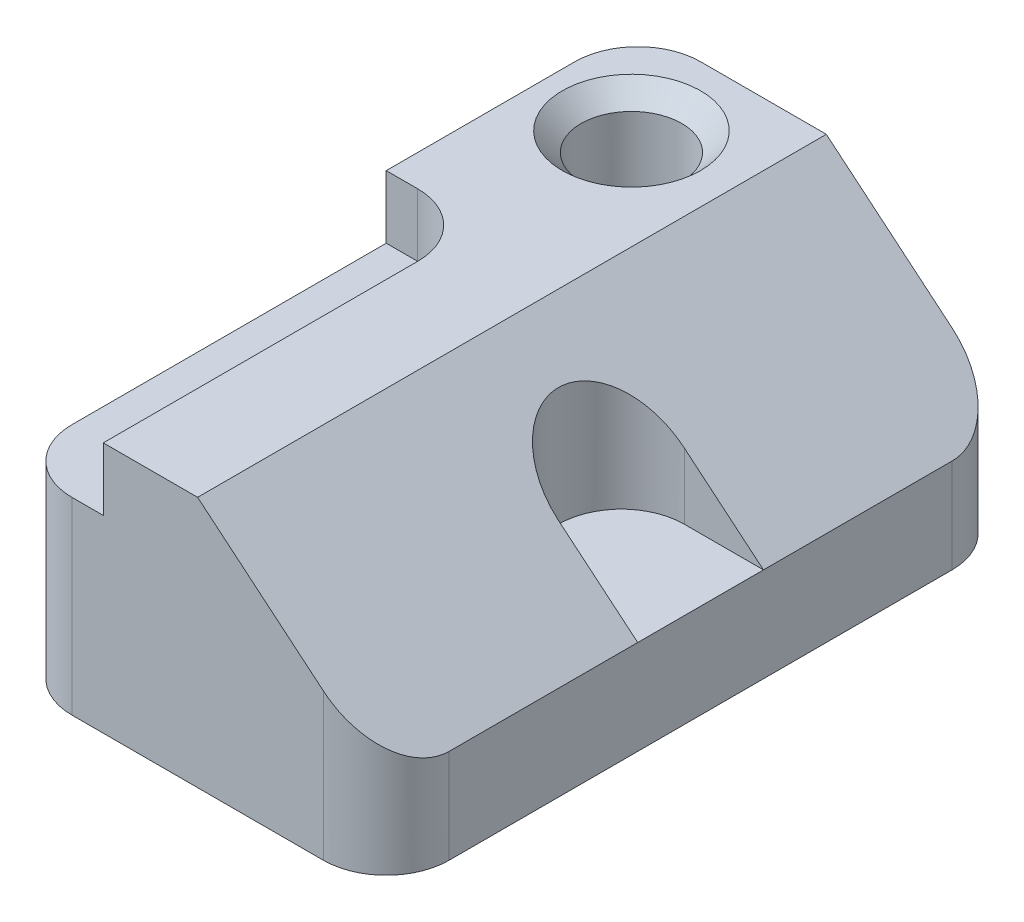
SolidWorks part; units mm, degrees
ref_plane "Front Plane" through (0, 0, 0) normal (0, 0, 1) x (1, 0, 0)
ref_plane "Top Plane" through (0, 0, 0) normal (0, 1, 0) x (1, 0, 0)
ref_plane "Right Plane" through (0, 0, 0) normal (1, 0, 0) x (0, 0, -1)
sketch "Sketch1" plane through (0, 0, 0) normal (0, 0, 1) x (1, 0, 0)
  line L0 (0, 0) -> (76.2, 0)
  line L1 (76.2, 0) -> (76.2, 19.05)
  line L2 (76.2, 19.05) -> (38.1, 50.8)
  line L3 (38.1, 50.8) -> (0, 50.8)
  line L4 (0, 50.8) -> (0, 0)
  dimension "D1" = 50.8
  dimension "D2" = 76.2
  dimension "D3" = 19.05
  dimension "D4" = 38.1
extrude "Extrude1" add sketch "Sketch1" along normal blind 127
sketch "Sketch2" plane through (0, 50.8, 0) normal (0, 1, 0) x (-1, 0, 0)
  line L0 (0, 127) -> (0, 0) construction
  line L1 (-38.1, 0) -> (0, 0) construction
  circle A0 centre (-17.78, 19.05) radius 10.16
  dimension "D1" = 20.32
  dimension "D2" = 17.78
  dimension "D3" = 19.05
extrude "Cut-Extrude1" cut sketch "Sketch2" against normal through all
chamfer "Chamfer1" distance 3.81 angle 45 1 edges at (7.62, 50.8, 19.05)
sketch "Sketch3" plane through (0, 50.8, 0) normal (0, 1, 0) x (-1, 0, 0)
  line L1 (0, 127) -> (-19.05, 127)
  line L2 (0, 127) -> (0, 50.8)
  line L3 (0, 50.8) -> (-6.35, 50.8)
  line L4 (-19.05, 127) -> (-19.05, 63.5)
  arc A0 (-6.35, 50.8) -> (-19.05, 63.5) centre (-6.35, 63.5) cw
  point P6 (-19.05, 50.8)
  dimension "D3" = 12.7
  dimension "D1" = 76.2
  dimension "D2" = 19.05
extrude "Cut-Extrude2" cut sketch "Sketch3" against normal blind 12.7
sketch "Sketch4" plane through (0, 50.8, 0) normal (0, 1, 0) x (-1, 0, 0)
  line L0 (-76.2, 76.2) -> (-60.198, 76.2)
  line L1 (-76.2, 127) -> (-76.2, 0) construction
  line L2 (-60.198, 50.8) -> (-76.2, 50.8)
  line L3 (-76.2, 50.8) -> (-76.2, 76.2)
  line L4 (-76.2, 63.5) -> (4.7843, 63.5) construction
  arc A0 (-60.198, 76.2) -> (-60.198, 50.8) centre (-60.198, 63.5) cw
  dimension "D2" = 12.7
  dimension "D1" = 16.002
extrude "Cut-Extrude3" cut sketch "Sketch4" against normal up to vertex (31.75 mm away)
fillet "Fillet4" radius 12.7 4 edges at (76.2, 9.525, 127) (0, 19.05, 127) (76.2, 9.525, 0) (0, 25.4, 0)
